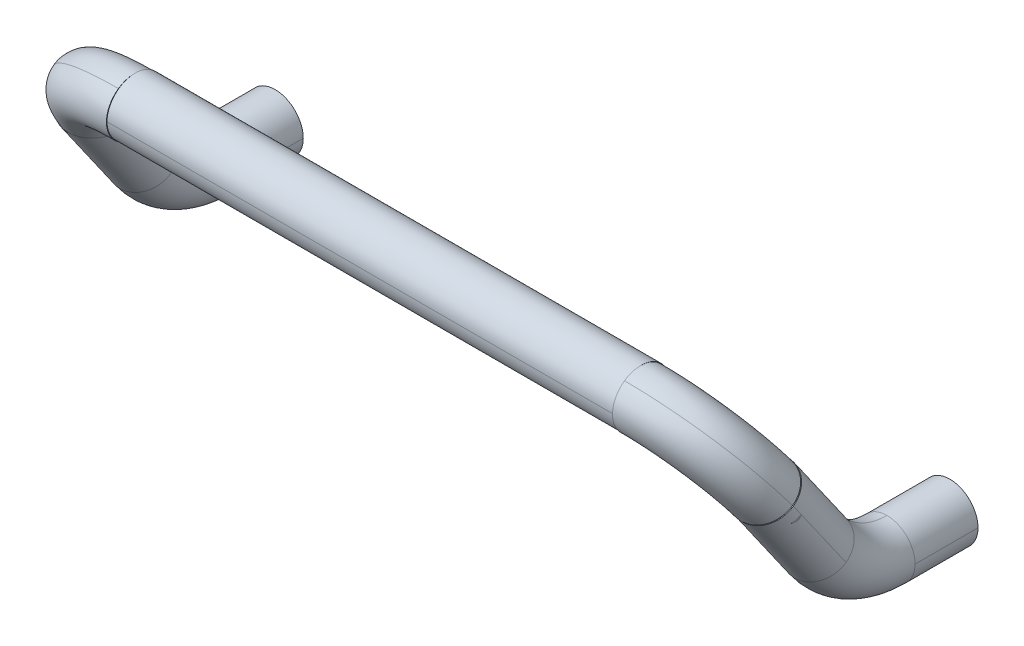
SolidWorks part; units mm, degrees
ref_plane "Front Plane" through (0, 0, 0) normal (0, 0, 1) x (1, 0, 0)
ref_plane "Top Plane" through (0, 0, 0) normal (0, 1, 0) x (1, 0, 0)
ref_plane "Right Plane" through (0, 0, 0) normal (1, 0, 0) x (0, 0, -1)
imported_body "21_1348_0_1.stp-1/2024_01_23_07_15_02_0830.stp-1-solid1"
sketch "Sketch1" plane through (0, 0, 0) normal (0, 0, -1) x (-1, 0, 0)
  circle A0 centre (0, 0) radius 3.046
  circle A1 centre (120, 0) radius 2.948
extrude "Boss-Extrude1" add sketch "Sketch1" against normal blind 19
sketch "Sketch2" plane through (0, 0, 0) normal (0, 0, -1) x (-1, 0, 0)
  point P0 (0, 0)
  point P1 (120, 0)
hole_wizard "Tap Drill for M5 Tap1" positions "Sketch2" profile "Sketch3" hole size "M5" standard "DIN"
sketch "Sketch3" plane through (0, 0, 0) normal (1, 0, 0) x (0, 1, 0)
  line L0 (0, 0) -> (0, 15.4618)
  line L1 (0, 15.4618) -> (2.1, 14.2)
  line L2 (2.1, 14.2) -> (2.1, 0)
  line L5 (2.1, 0) -> (0, 0)
  line L10 (0, 15.4618) -> (-2.1, 14.2) construction
  line L11 (0, -6.35) -> (0, 107.95) construction
  dimension "Hole Dia." = 4.2
  dimension "Hole Depth" = 14.2
  dimension "Drill Angle" = 118
